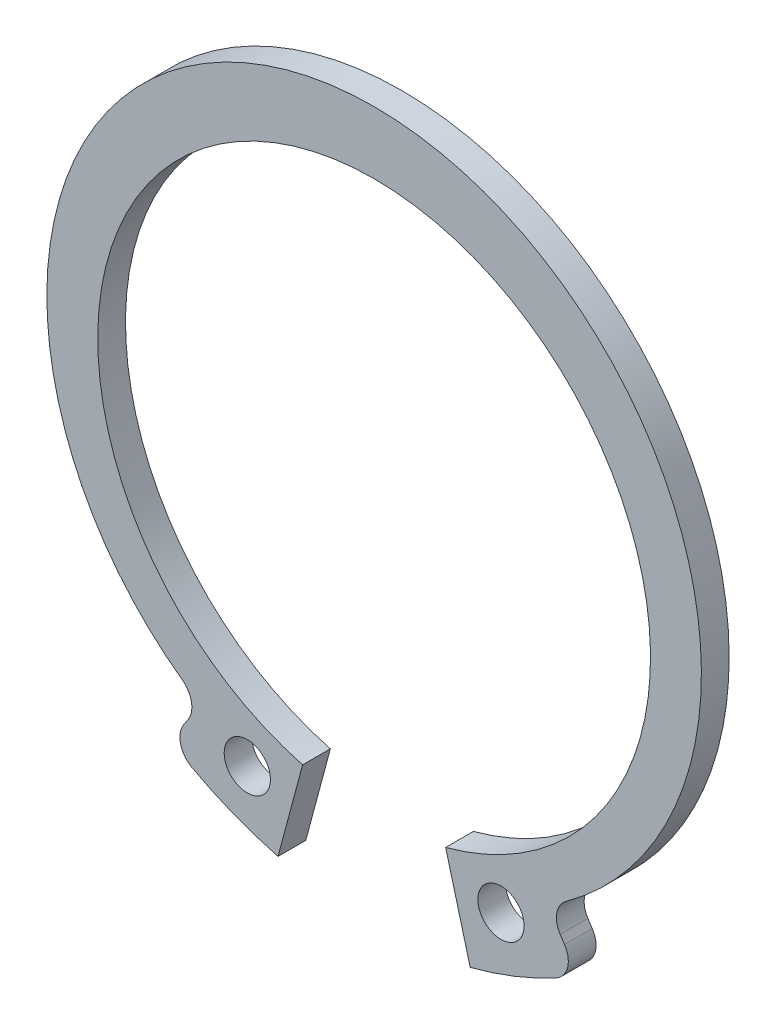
SolidWorks part; units mm, degrees
ref_plane "Plan1" through (0, 0, 0) normal (0, 0, 1) x (1, 0, 0)
ref_plane "Plan2" through (0, 0, 0) normal (0, 1, 0) x (1, 0, 0)
ref_plane "Plan3" through (0, 0, 0) normal (1, 0, 0) x (0, 0, -1)
sketch "Esquisse1" plane through (0, 0, 0) normal (0, 0, 1) x (1, 0, 0)
  line L0 (0, 0) -> (4.154, -15.5031) construction
  line L1 (0, 0) -> (0, -67.082) construction
  line L2 (8.0434, -12.3208) -> (8.234, -12.6127)
  line L3 (3.0929, -11.5428) -> (4.154, -15.5031)
  line L4 (-3.0929, -11.5428) -> (-4.154, -15.5031)
  line L5 (-8.0434, -12.3208) -> (-8.234, -12.6127)
  line L6 (3.0929, -11.5428) -> (7.8728, -14.0387) construction
  line L7 (0, 0) -> (0, 11.95) construction
  line L8 (0, 11.95) -> (0, 14.65) construction
  arc A0 (3.0929, -11.5428) -> (-3.0929, -11.5428) centre (0, 0) ccw
  arc A1 (4.154, -15.5031) -> (7.8728, -14.0387) centre (0, 0.5) ccw
  arc A2 (8.2946, -10.964) -> (-8.2946, -10.964) centre (0, 0.5) ccw
  arc A3 (-7.8728, -14.0387) -> (-4.154, -15.5031) centre (0, 0.5) ccw
  arc A4 (-8.2946, -10.964) -> (-8.0434, -12.3208) centre (-8.8807, -11.7742) cw
  arc A5 (8.2946, -10.964) -> (8.0434, -12.3208) centre (8.8807, -11.7742) ccw
  circle A6 centre (5.4828, -12.7908) radius 1
  circle A7 centre (-5.4828, -12.7908) radius 1
  arc A8 (-7.8728, -14.0387) -> (-8.234, -12.6127) centre (-7.3966, -13.1594) cw
  arc A9 (7.8728, -14.0387) -> (8.234, -12.6127) centre (7.3966, -13.1594) ccw
  point P22 (-8.808, -13.492)
extrude "Base-Extrusion" add sketch "Esquisse1" along normal blind 1.2
equation "\"R@Esquisse1\" = \"D8@Esquisse1\"/2"
equation "\"D4@Esquisse1\"=\"R@Esquisse1\"/2"
equation "\"D5@Esquisse1\"=\"D8@Esquisse1\"*2.5"
